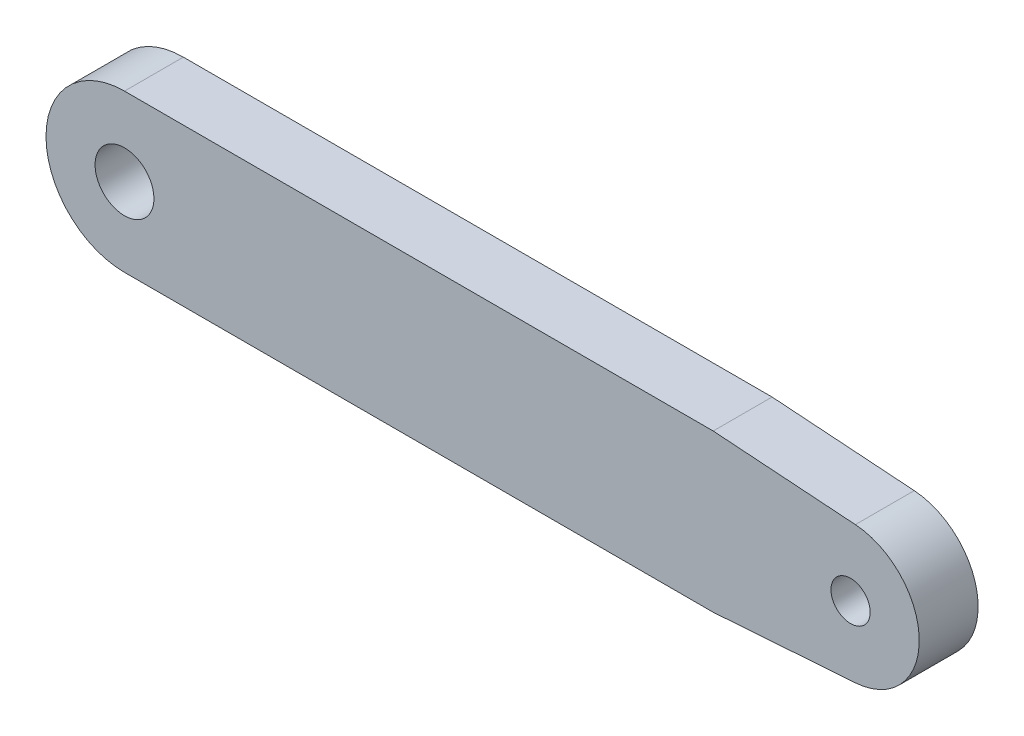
SolidWorks part; units mm, degrees
ref_plane "Front" through (0, 0, 0) normal (0, 0, 1) x (1, 0, 0)
ref_plane "Top" through (0, 0, 0) normal (0, 1, 0) x (1, 0, 0)
ref_plane "Right" through (0, 0, 0) normal (1, 0, 0) x (0, 0, -1)
sketch "Esquisse1" plane through (0, 0, 0) normal (0, 0, 1) x (1, 0, 0)
  line L0 (50, 0) -> (-50, 0) construction
  line L1 (-37, 4) -> (-7, 4)
  line L2 (-7, 4) -> (0.2451, 3.4914)
  line L3 (-60.7799, 0) -> (10.8328, 0) construction
  line L4 (-7, -4) -> (0.2451, -3.4914)
  line L5 (-37, -4) -> (-7, -4)
  arc A0 (0.2451, -3.4914) -> (0.2451, 3.4914) centre (0, 0) ccw
  arc A1 (-37, 4) -> (-37, -4) centre (-37, 0) ccw
  circle A2 centre (-37, 0) radius 1.5
  circle A3 centre (0, 0) radius 1
  dimension "D1" = 8
  dimension "D2" = 7
  dimension "D5" = 3
  dimension "D6" = 2
  dimension "D3" = 30
  dimension "D4" = 37
extrude "Boss.-Extru.1" add sketch "Esquisse1" along normal blind 3
